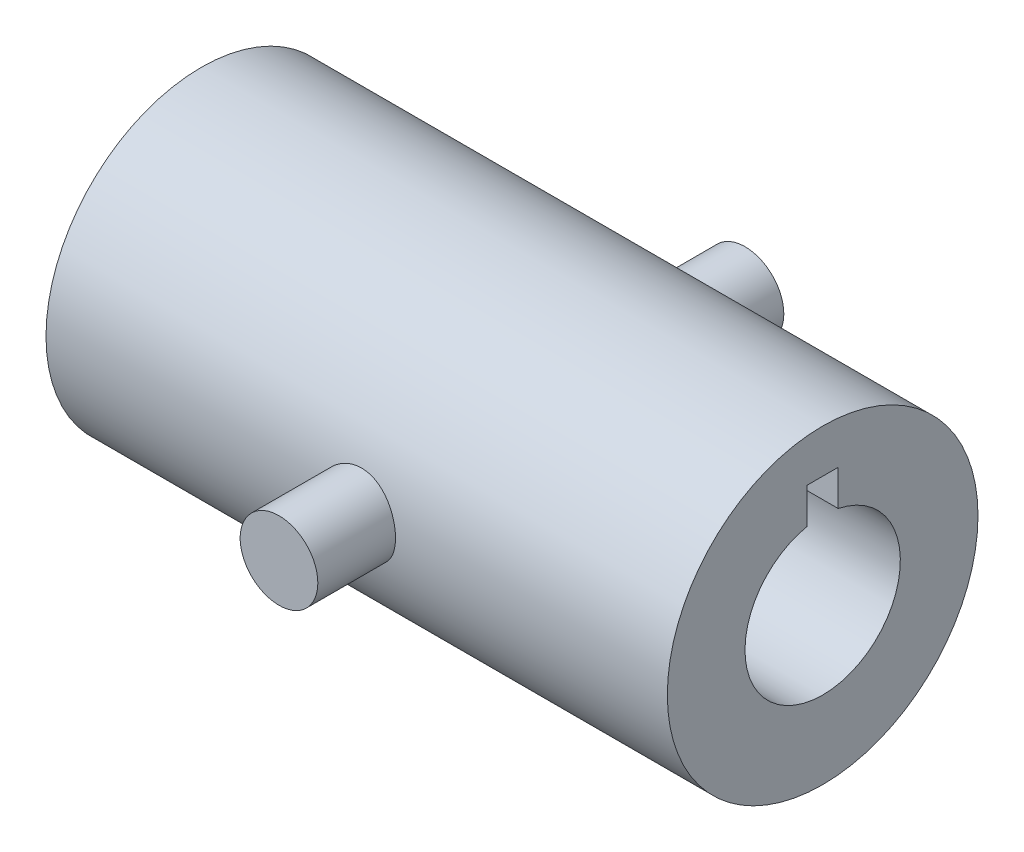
SolidWorks part; units mm, degrees
ref_plane "Front Plane" through (0, 0, 0) normal (0, 0, 1) x (1, 0, 0)
ref_plane "Top Plane" through (0, 0, 0) normal (0, 1, 0) x (1, 0, 0)
ref_plane "Right Plane" through (0, 0, 0) normal (1, 0, 0) x (0, 0, -1)
sketch "Sketch1" plane through (0, 0, 0) normal (1, 0, 0) x (0, 0, -1)
  line L0 (-1.27, 6.2217) -> (-1.27, 9.1417)
  line L1 (-1.27, 9.1417) -> (1.27, 9.1417)
  line L2 (1.27, 9.1417) -> (1.27, 6.2217)
  line L3 (0, 0) -> (-0.2381, 9.8868) construction
  circle A0 centre (0, 0) radius 12.7
  arc A1 (-1.27, 6.2217) -> (1.27, 6.2217) centre (0, 0) ccw
  dimension "D1" = 25.4
  dimension "D2" = 12.7
  dimension "D3" = 2.54
  dimension "D4" = 2.92
extrude "Boss-Extrude1" add sketch "Sketch1" along normal blind 50.8
sketch "Sketch2" plane through (0, 0, 0) normal (0, 0, 1) x (1, 0, 0)
  circle A0 centre (25.4, 0) radius 3.175
  dimension "D2" = 6.35
  dimension "D1" = 25.4
extrude "Boss-Extrude2" add sketch "Sketch2" along normal mid plane 38.1
sketch "Sketch3" plane through (0, 0, 0) normal (1, 0, 0) x (0, 0, -1)
  circle A0 centre (0, 0) radius 6.35
extrude "Cut-Extrude1" cut sketch "Sketch3" along normal through all
